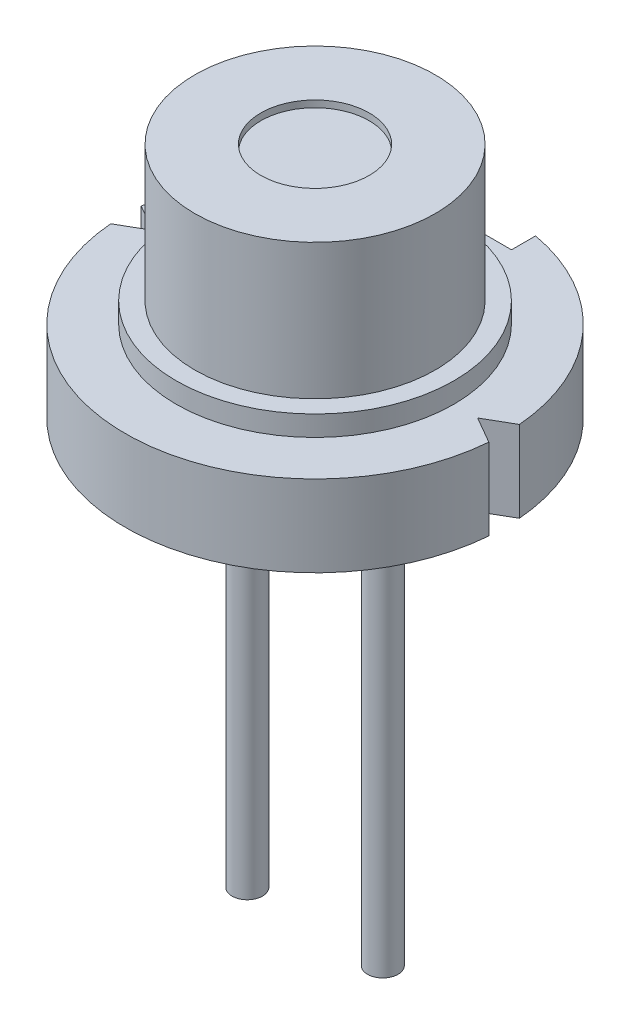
SolidWorks part; units mm, degrees
ref_plane "前视基准面" through (0, 0, 0) normal (0, 0, 1) x (1, 0, 0)
ref_plane "上视基准面" through (0, 0, 0) normal (0, 1, 0) x (1, 0, 0)
ref_plane "右视基准面" through (0, 0, 0) normal (1, 0, 0) x (0, 0, -1)
sketch "草图1" plane through (0, 0, 0) normal (0, 1, 0) x (1, 0, 0)
  circle A0 centre (0, 0) radius 2.8
  dimension "D1" = 5.6
extrude "凸台-拉伸1" add sketch "草图1" along normal blind 1.2
sketch "草图2" plane through (0, 1.2, 0) normal (0, 1, 0) x (1, 0, 0)
  circle A0 centre (0, 0) radius 2.05
  dimension "D1" = 4.1
extrude "凸台-拉伸2" add sketch "草图2" along normal blind 0.3
sketch "草图3" plane through (0, 1.5, 0) normal (0, 1, 0) x (1, 0, 0)
  circle A0 centre (0, 0) radius 1.775
  dimension "D1" = 3.55
extrude "凸台-拉伸3" add sketch "草图3" along normal blind 2
sketch "草图4" plane through (0, 3.5, 0) normal (0, 1, 0) x (1, 0, 0)
  circle A0 centre (0, 0) radius 0.8
  dimension "D1" = 1.6
extrude "切除-拉伸1" cut sketch "草图4" against normal blind 0.1
sketch "草图5" plane through (0, 1.2, 0) normal (0, 1, 0) x (1, 0, 0)
  line L0 (0, 0) -> (0, 3.1216) construction
  line L1 (0.5, 2.4) -> (0.5, 2.755)
  line L2 (-0.5, 2.4) -> (-0.5, 2.755)
  line L3 (0.5, 2.4) -> (-0.5, 2.4)
  line L4 (0.5, 0) -> (0.5, 3.1216) construction
  line L5 (-0.5, 0) -> (-0.5, 3.1216) construction
  line L6 (0, 0) -> (-3.903, 0) construction
  line L7 (-2.4, 0) -> (-2.7909, -0.2257)
  line L8 (-2.4, 0) -> (-2.7909, 0.2257)
  line L9 (2.4, 0) -> (2.7909, 0.2257)
  line L10 (2.4, 0) -> (2.7909, -0.2257)
  circle A0 centre (0, 0) radius 2.8 construction
  arc A2 (0.5, 2.755) -> (-0.5, 2.755) centre (0, 0) ccw
  arc A3 (-2.7909, 0.2257) -> (-2.7909, -0.2257) centre (0, 0) ccw
  arc A4 (2.7909, 0.2257) -> (2.7909, -0.2257) centre (0, 0) cw
  dimension "D3" = 2.4
  dimension "D4" = 2.4
  dimension "D5" = 30
  dimension "D6" = 30
  dimension "D1" = 0.5
  dimension "D2" = 0.5
extrude "切除-拉伸2" cut sketch "草图5" against normal through all
sketch "草图6" plane through (0, 0, 0) normal (0, -1, 0) x (1, 0, 0)
  line L0 (-1.5981, 0) -> (2.0737, 0) construction
  line L1 (0, 1.2464) -> (0, -1.8407) construction
  circle A0 centre (0, 0) radius 1 construction
  circle A1 centre (-1, 0) radius 0.225
  circle A2 centre (0, -1) radius 0.225
  circle A3 centre (1, 0) radius 0.225
  dimension "D1" = 2
  dimension "D2" = 0.45
extrude "凸台-拉伸4" add sketch "草图6" along normal blind 6.5
fillet "圆角1" radius 0.4 3 edges at (1, 0, 0.225) (0, 0, -0.775) (-1, 0, 0.225)
